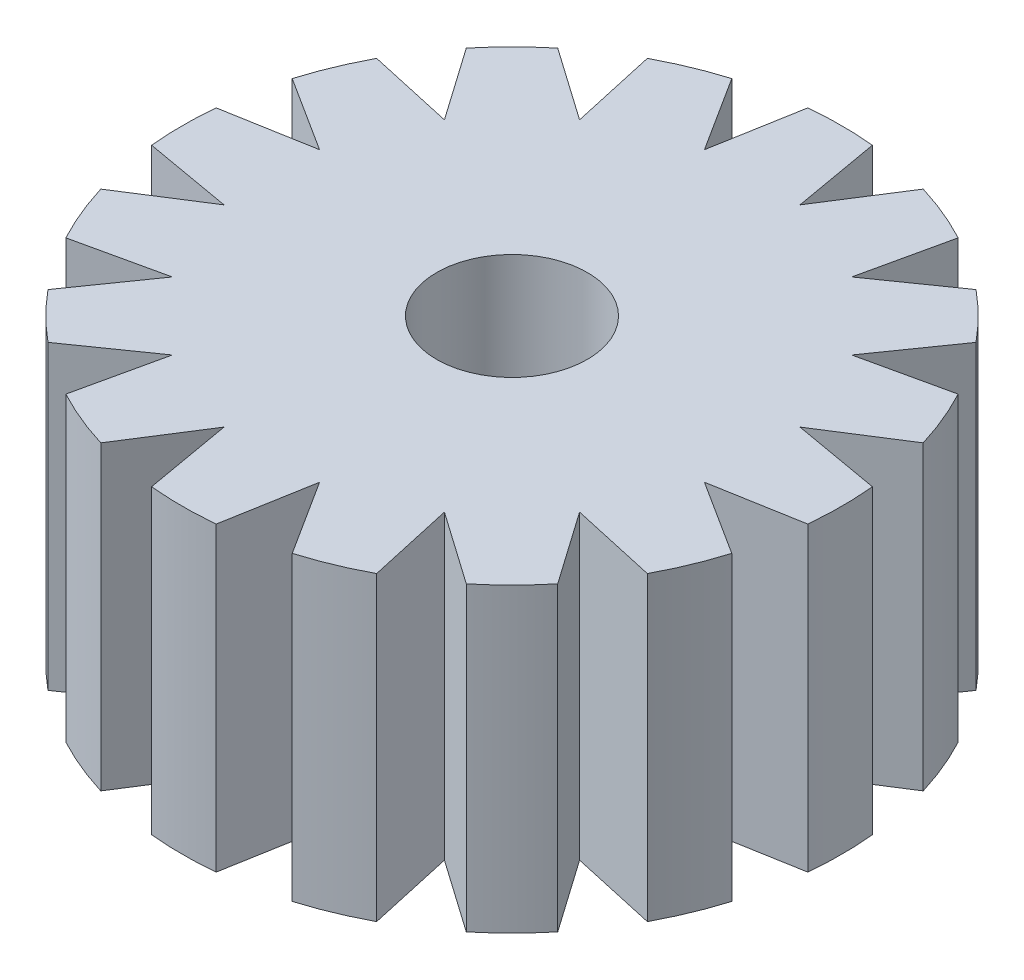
SolidWorks part; units mm, degrees
ref_plane "前视基准面" through (0, 0, 0) normal (0, 0, 1) x (1, 0, 0)
ref_plane "上视基准面" through (0, 0, 0) normal (0, 1, 0) x (1, 0, 0)
ref_plane "右视基准面" through (0, 0, 0) normal (1, 0, 0) x (0, 0, -1)
sketch "草图1" plane through (0, 0, 0) normal (0, 1, 0) x (1, 0, 0)
  line L5 (3.6112, 5.4046) -> (4.1247, 7.7168)
  line L6 (2.54, 8.3732) -> (1.2681, 6.3751)
  arc A3 (2.54, 8.3732) -> (4.1247, 7.7168) centre (0, 0) cw
  arc A4 (3.6112, 5.4046) -> (-3.6112, -5.4046) centre (0, 0) cw
  arc A5 (1.2681, 6.3751) -> (-3.6112, -5.4046) centre (-0.0028, 0.0011) ccw
  point P3 (1.2681, 6.3751)
  point P9 (3.6112, 5.4046)
extrude "凸台-拉伸1" add sketch "草图1" along normal blind 8
pattern_circular "阵列(圆周)1" count 16 over 360 about axis through (0, 0, 0) along (0, 1, 0) of "凸台-拉伸1"
sketch "草图2" plane through (0, 8, 0) normal (0, 1, 0) x (1, 0, 0)
  circle A0 centre (0, 0) radius 2
extrude "切除-拉伸1" cut sketch "草图2" against normal blind 17
